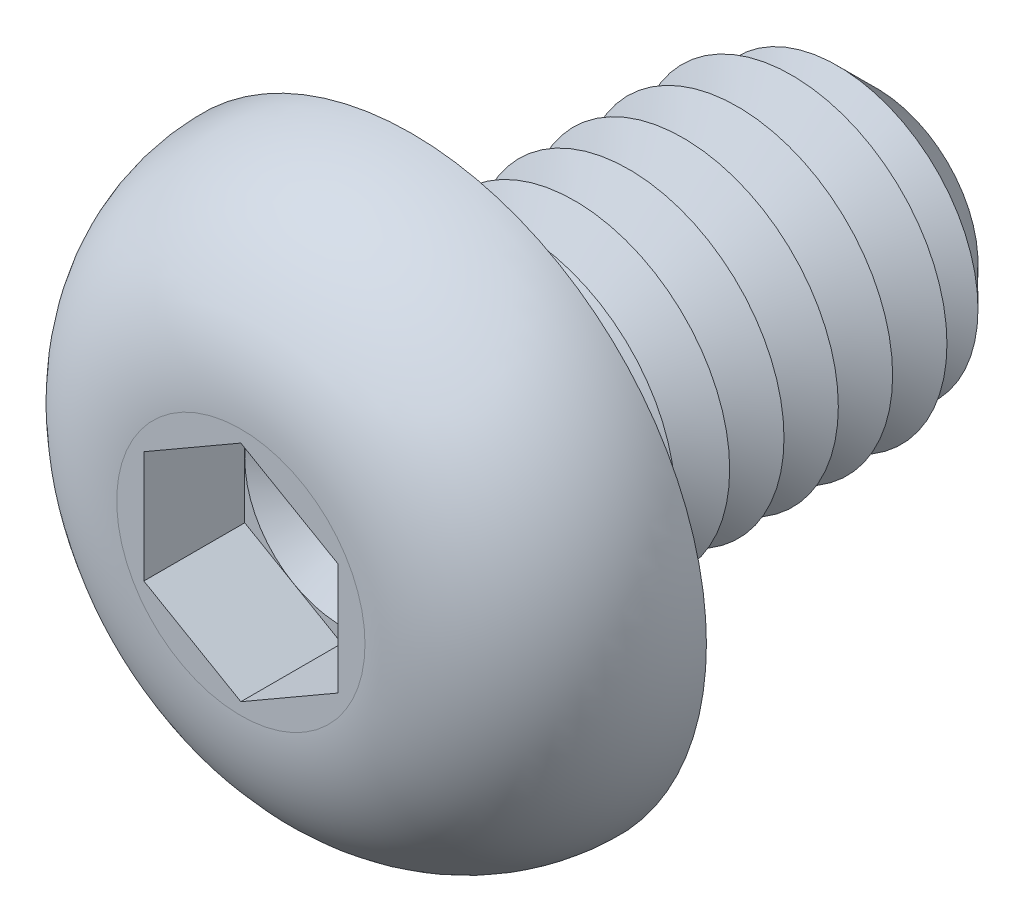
SolidWorks part; units mm, degrees
ref_plane "Front Plane" through (0, 0, 0) normal (0, 0, 1) x (1, 0, 0)
ref_plane "Top Plane" through (0, 0, 0) normal (0, 1, 0) x (1, 0, 0)
ref_plane "Right Plane" through (0, 0, 0) normal (1, 0, 0) x (0, 0, -1)
sketch "Sketch1" plane through (0, 0, 0) normal (1, 0, 0) x (0, 0, -1)
  line L0 (-47.9342, 0) -> (60.3146, 0) construction
sketch "Sketch2" plane through (0, 0, 0) normal (1, 0, 0) x (0, 0, -1)
  line L0 (0, 0) -> (-2.2, 0)
  line L1 (-47.9342, 0) -> (60.3146, 0) construction
  line L2 (-2.2, 0) -> (-2.2, 1.6)
  line L3 (0, 3.8) -> (0, 0)
  arc A0 (-2.2, 1.6) -> (0, 3.8) centre (0, 1.6) cw
  dimension "D1" = 2.2
  dimension "D2" = 2.2
  dimension "D3" = 3.8
revolve "Revolve1" add sketch "Sketch2" angle 360 about L0
sketch "Sketch3" plane through (0, 0, 2.2) normal (0, 0, 1) x (1, 0, 0)
  line L1 (0, 1.4434) -> (-1.25, 0.7217)
  line L2 (-1.25, 0.7217) -> (-1.25, -0.7217)
  line L3 (-1.25, -0.7217) -> (0, -1.4434)
  line L4 (0, -1.4434) -> (1.25, -0.7217)
  line L5 (1.25, -0.7217) -> (1.25, 0.7217)
  line L6 (1.25, 0.7217) -> (0, 1.4434)
  circle A0 centre (0, 0) radius 1.25 construction
  dimension "D1" = 2.5
extrude "Cut-Extrude1" cut sketch "Sketch3" against normal blind 1.3
sketch "Sketch4" plane through (0, 0, 0) normal (0, 0, -1) x (-1, 0, 0)
  circle A0 centre (0, 0) radius 2
  dimension "D1" = 4
extrude "Boss-Extrude1" add sketch "Sketch4" along normal blind 6
chamfer "Chamfer1" distance 0.7 angle 45 1 edges at (-2, 0, -6)
sketch "Sketch5" plane through (0, 0, 0) normal (1, 0, 0) x (0, 0, -1)
  line L0 (0.7, 2) -> (1.4, 2)
  line L1 (5.3, 2) -> (0, 2) construction
  line L2 (1.4, 2) -> (1.05, 1.3938)
  line L3 (1.05, 1.3938) -> (0.7, 2)
  line L4 (0, -3.8) -> (0, 3.8) construction
  line L5 (5.3, 2) -> (0, 2) construction
  dimension "D1" = 0.7
  dimension "D2" = 0.7
revolve "Cut-Revolve1" cut sketch "Sketch5" angle 360 about L0
pattern_linear "LPattern1" count 7 spacing 0.7 along (0, 0, -1) of "Cut-Revolve1"
fillet "Fillet2" radius 0.3 1 edges at (2, 0, 0)
sketch "Sketch6" plane through (0, 0, 0.9) normal (0, 0, 1) x (1, 0, 0)
  line L0 (0, -1.4434) -> (1.25, -0.7217) construction
  circle A0 centre (0, 0) radius 1.25
extrude "Cut-Extrude2" cut sketch "Sketch6" against normal through all draft 60
